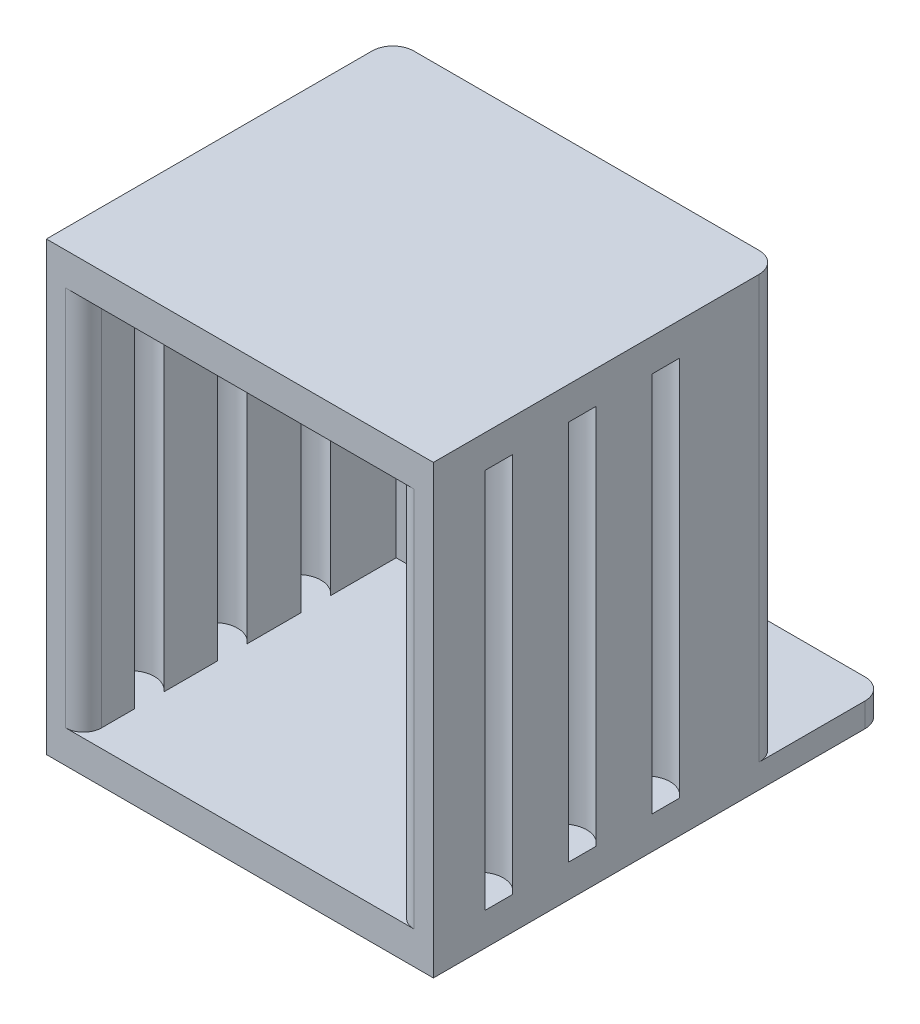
SolidWorks part; units mm, degrees
ref_plane "Front Plane" through (0, 0, 0) normal (0, 0, 1) x (1, 0, 0)
ref_plane "Top Plane" through (0, 0, 0) normal (0, 1, 0) x (1, 0, 0)
ref_plane "Right Plane" through (0, 0, 0) normal (1, 0, 0) x (0, 0, -1)
sketch "Sketch1" plane through (0, 0, 0) normal (0, 1, 0) x (1, 0, 0)
  line L0 (-55, 0) -> (55, 0) construction
  line L1 (-16.51, 0) -> (16.51, 0)
  line L2 (-16.51, 0) -> (-16.51, 29.5656)
  line L3 (-16.51, 29.5656) -> (16.51, 29.5656)
  line L4 (16.51, 0) -> (16.51, 29.5656)
  line L5 (0, -55) -> (0, 55) construction
  dimension "D1" = 33.02
  dimension "D2" = 16.51
  dimension "D3" = 29.5656
extrude "Extrude1" add sketch "Sketch1" along normal blind 38.1
sketch "Sketch2" plane through (0, 0, 0) normal (0, 0, 1) x (1, 0, 0)
  line L0 (0, -16.2611) -> (0, 16.2611) construction
  line L1 (-13.335, 2.794) -> (13.335, 2.794)
  line L2 (-13.335, 2.794) -> (-13.335, 35.306)
  line L3 (-13.335, 35.306) -> (13.335, 35.306)
  line L4 (13.335, 2.794) -> (13.335, 35.306)
  line L5 (-16.51, 38.1) -> (16.51, 38.1) construction
  line L6 (16.2611, 0) -> (-16.2611, 0) construction
  dimension "D1" = 13.335
  dimension "D2" = 26.67
  dimension "D3" = 2.794
  dimension "D4" = 2.794
extrude "Cut-Extrude1" cut sketch "Sketch2" against normal blind 26.67
sketch "Sketch3" plane through (0, 0, 0) normal (0, -1, 0) x (1, 0, 0)
  line L0 (16.51, 0) -> (16.51, -29.5656) construction
  line L1 (-16.51, -38.608) -> (16.51, -38.608)
  line L2 (-16.51, -38.608) -> (-16.51, -29.5656)
  line L3 (-16.51, -29.5656) -> (16.51, -29.5656)
  line L4 (16.51, -38.608) -> (16.51, -29.5656)
  line L5 (18.161, 0) -> (-18.161, 0) construction
  line L6 (-16.51, -29.5656) -> (-16.51, 0) construction
  line L7 (16.51, -29.5656) -> (-16.51, -29.5656) construction
  dimension "D1" = 38.608
extrude "Extrude2" add sketch "Sketch3" against normal blind 2.0574
fillet "Fillet1" radius 1.778 2 edges
ref_plane "Plane1" through (0, 19.05, 0) normal (0, 1, 0) x (-1, 0, 0)
sketch "Sketch4" plane through (0, 19.05, 0) normal (0, 1, 0) x (-1, 0, 0)
  line L0 (16.51, 0) -> (-16.51, 0) construction
  line L1 (0, 16.2611) -> (0, -16.2611) construction
  line L2 (-14.8908, -5.588) -> (-14.8908, -12.4166) construction
  circle A0 centre (-14.8908, -5.588) radius 2.0003
  circle A1 centre (-14.8907, -12.7) radius 2.0003
  circle A2 centre (-14.8907, -19.812) radius 2.0003
  dimension "D1" = 4.0005
  dimension "D2" = 4.0005
  dimension "D3" = 4.0005
  dimension "D4" = 5.588
  dimension "D5" = 7.112
  dimension "D6" = 7.112
  dimension "D7" = 14.8908
extrude "Cut-Extrude2" cut sketch "Sketch4" against normal mid plane 32.512
mirror "Mirror1" about plane through (0, 0, 0) normal (1, 0, 0) of "Cut-Extrude2"
fillet "Fillet2" radius 1.778 2 edges at (-16.51, 1.0287, -38.608) (16.51, 1.0287, -38.608)
fillet "Fillet3" radius 1.524 2 edges at (13.335, 19.05, 0) (-13.335, 19.05, 0)
